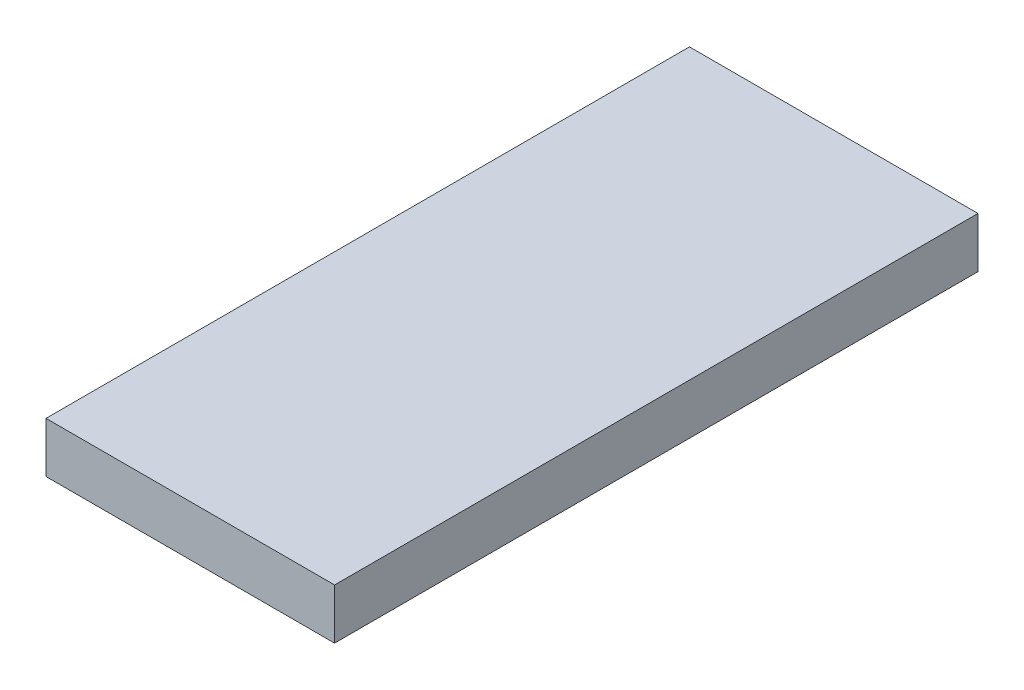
SolidWorks part; units mm, degrees
ref_plane "Front Plane" through (0, 0, 0) normal (1, 0, 0) x (0, 1, 0)
ref_plane "Top Plane" through (0, 0, 0) normal (0, 0, 1) x (0, 1, 0)
ref_plane "Right Plane" through (0, 0, 0) normal (0, 1, 0) x (-1, 0, 0)
sketch "sk w193" plane through (0, 0, 0) normal (0, 0, 1) x (0, 1, 0)
  point P0 (-399.034, -196.596)
  point P3 (-188.214, 0)
  line B0 (-399.034, -196.596) -> (-399.034, -160.02)
  line B1 (-399.034, -160.02) -> (-226.06, -160.02)
  line B2 (-210.82, -144.78) -> (-210.82, 144.78)
  line B3 (-226.06, 160.02) -> (-399.034, 160.02)
  line B4 (-399.034, 160.02) -> (-399.034, 196.596)
  line B5 (-399.034, 196.596) -> (0, 196.596)
  line B6 (0, 196.596) -> (0, 160.02)
  line B7 (0, 160.02) -> (-172.974, 160.02)
  line B8 (-188.214, 144.78) -> (-188.214, -144.78)
  line B9 (-172.974, -160.02) -> (0, -160.02)
  line B10 (0, -160.02) -> (0, -196.596)
  line B11 (0, -196.596) -> (-399.034, -196.596)
  arc B12 (-226.06, -160.02) -> (-210.82, -144.78) centre (-226.06, -144.78) ccw
  arc B13 (-210.82, 144.78) -> (-226.06, 160.02) centre (-226.06, 144.78) ccw
  arc B14 (-172.974, 160.02) -> (-188.214, 144.78) centre (-172.974, 144.78) ccw
  arc B15 (-188.214, -144.78) -> (-172.974, -160.02) centre (-172.974, -144.78) ccw
sketch_block_instance "w14x193-1-1"
sketch_block "w14x193-1" parameters "D4"=15.24, "D1"=399.034, "D2"=393.192, "D3"=22.606, "D5"=36.576
sketch "Sketch2" plane through (0, 0, 0) normal (0, 0, 1) x (0, 1, 0)
  line L0 (320, 501.4782) -> (320, -809.7231)
  line L1 (-188.214, 144.78) -> (-188.214, -144.78)
  line L2 (-188.214, -144.78) -> (-172.974, -160.02)
  line L3 (-172.974, -160.02) -> (5, -160.02)
  line L4 (-188.214, 144.78) -> (-172.974, 160.02)
  line L5 (-172.974, 160.02) -> (5, 160.02)
  line L6 (5, 201.596) -> (5, 160.02)
  line L7 (0, 196.596) -> (0, 160.02) construction
  line L8 (5, -160.02) -> (5, -201.596)
  line L9 (-285.82, 201.596) -> (5, 201.596)
  line L10 (-285.82, -201.596) -> (5, -201.596)
  line L11 (-285.82, 201.596) -> (-285.82, 239.696)
  line L12 (-285.82, 239.696) -> (167.6, 501.4782)
  line L13 (-285.82, -201.596) -> (-285.82, -239.696)
  line L14 (-285.82, -239.696) -> (167.6, -809.7231)
  line L15 (-210.82, -144.78) -> (-210.82, 144.78) construction
  line L16 (-399.034, 196.596) -> (0, 196.596) construction
  line L17 (0, -196.596) -> (-399.034, -196.596) construction
  line L18 (320, 501.4782) -> (167.6, 501.4782)
  line L19 (320, -809.7231) -> (167.6, -809.7231)
  point P30 (320, 501.4782)
  point P31 (320, -809.7231)
  dimension "D1" = 320
  dimension "D2" = 5
  dimension "D3" = 75
  dimension "D4" = 5
  dimension "D5" = 5
  dimension "D6" = 30
  dimension "D7" = 51.5
  dimension "D8" = 38.1
  dimension "D9" = 38.1
  dimension "D10" = 152.4
sketch "Sketch3" plane through (0, 0, 0) normal (0, 1, 0) x (-1, 0, 0)
  line L6 (-145.41, 324.25) -> (145.41, 324.25)
  line L7 (-145.41, 324.25) -> (-145.41, -324.25)
  line L8 (-145.41, -324.25) -> (145.41, -324.25)
  line L9 (145.41, 324.25) -> (145.41, -324.25)
  point P4 (0, 324.25)
  point P5 (145.41, 0)
  dimension "D1" = 648.5
  dimension "D2" = 290.82
extrude "Boss-Extrude1" add sketch "Sketch3" along normal blind 50.8
